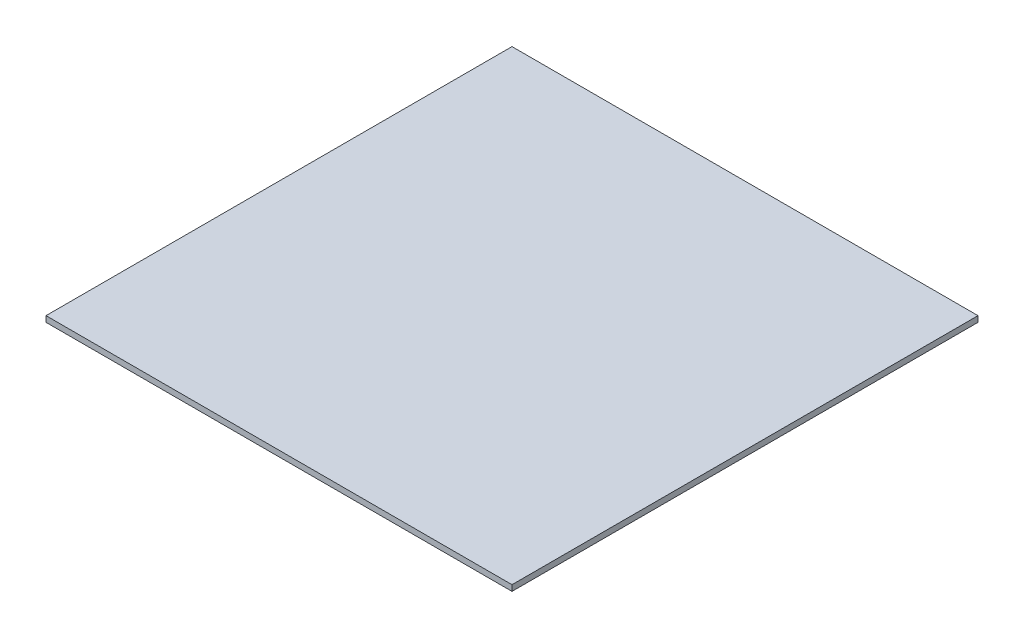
SolidWorks part; units mm, degrees
ref_plane "Front Plane" through (0, 0, 0) normal (0, 0, 1) x (1, 0, 0)
ref_plane "Top Plane" through (0, 0, 0) normal (0, 1, 0) x (1, 0, 0)
ref_plane "Right Plane" through (0, 0, 0) normal (1, 0, 0) x (0, 0, -1)
sketch "Sketch1" plane through (0, 0, 0) normal (0, 1, 0) x (1, 0, 0)
  line L1 (0, 0) -> (400, 0)
  line L2 (0, 0) -> (0, 400)
  line L3 (0, 400) -> (400, 400)
  line L4 (400, 0) -> (400, 400)
  dimension "D1" = 400
  dimension "D2" = 400
extrude "Boss-Extrude1" add sketch "Sketch1" along normal blind 5
